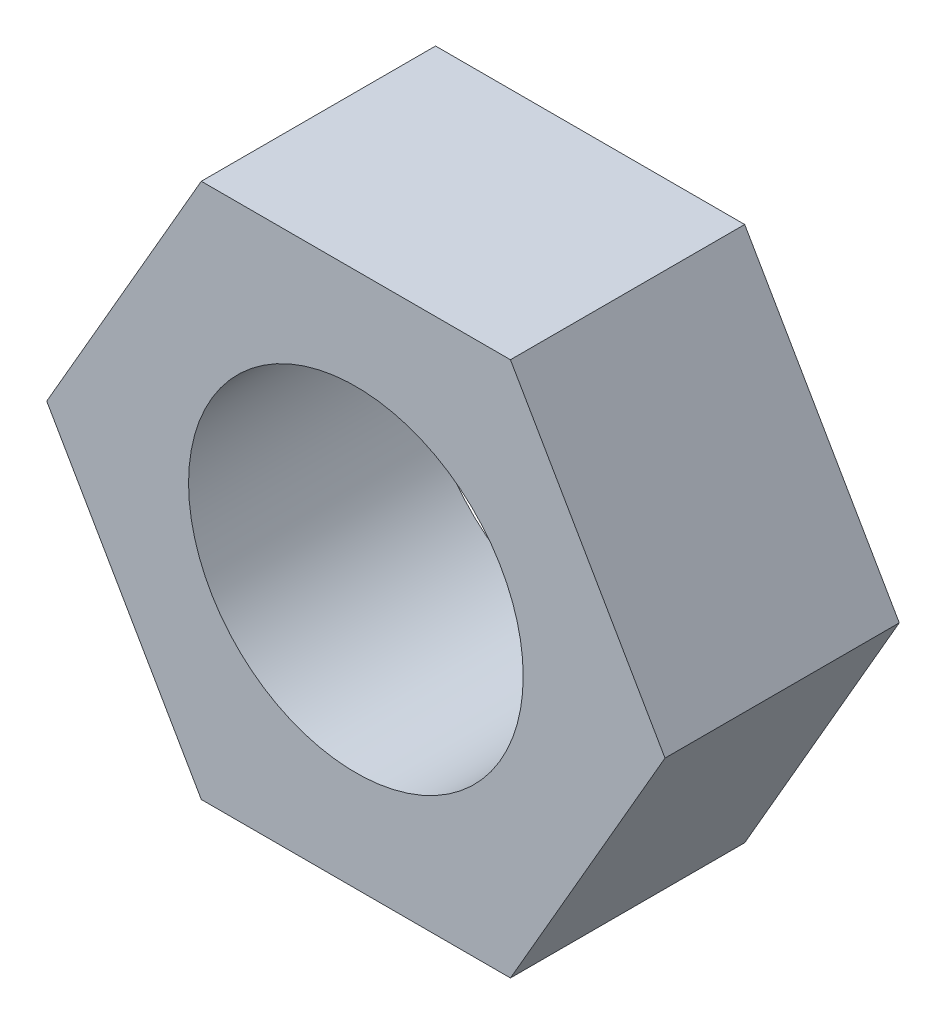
SolidWorks part; units mm, degrees
ref_plane "前视基准面" through (0, 0, 0) normal (0, 0, 1) x (1, 0, 0)
ref_plane "上视基准面" through (0, 0, 0) normal (0, 1, 0) x (1, 0, 0)
ref_plane "右视基准面" through (0, 0, 0) normal (1, 0, 0) x (0, 0, -1)
sketch "草图1" plane through (0, 0, 0) normal (0, 0, 1) x (1, 0, 0)
  line L1 (4.6188, 0) -> (2.3094, 4)
  line L2 (2.3094, 4) -> (-2.3094, 4)
  line L3 (-2.3094, 4) -> (-4.6188, 0)
  line L4 (-4.6188, 0) -> (-2.3094, -4)
  line L5 (-2.3094, -4) -> (2.3094, -4)
  line L6 (2.3094, -4) -> (4.6188, 0)
  circle A0 centre (0, 0) radius 4 construction
  circle A1 centre (0, 0) radius 2.5
  dimension "D1" = 5
  dimension "D2" = 8
extrude "凸台-拉伸1" add sketch "草图1" along normal blind 3.5
